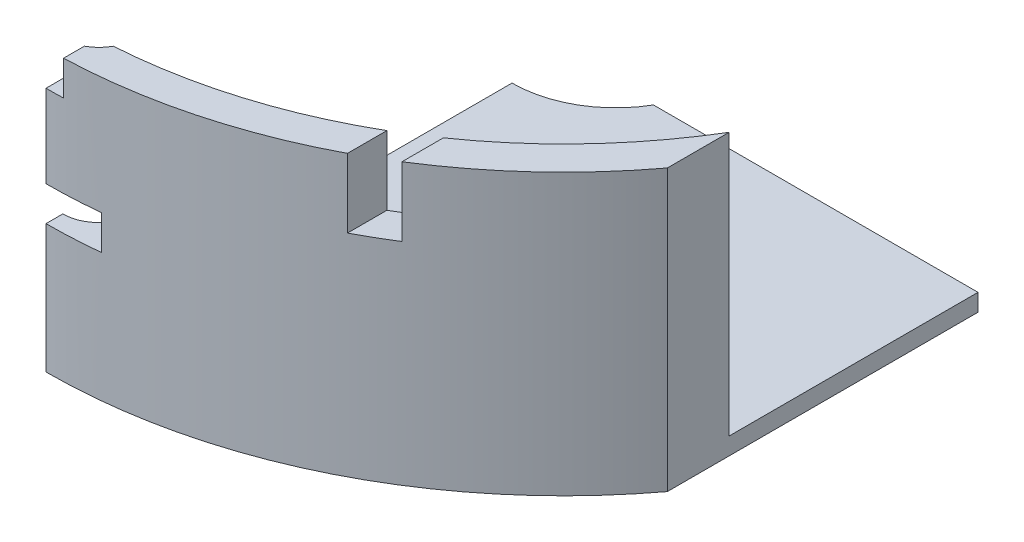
SolidWorks part; units mm, degrees
ref_plane "Front Plane" through (0, 0, 0) normal (0, 0, 1) x (1, 0, 0)
ref_plane "Top Plane" through (0, 0, 0) normal (0, 1, 0) x (1, 0, 0)
ref_plane "Right Plane" through (0, 0, 0) normal (1, 0, 0) x (0, 0, -1)
sketch "Sketch1" plane through (0, 0, 0) normal (0, 1, 0) x (1, 0, 0)
  line L0 (0, 0) -> (150, 0)
  line L1 (150, 0) -> (-150, 0)
  circle A0 centre (0, 0) radius 150
  circle A1 centre (0, 0) radius 145
  dimension "D1" = 300
  dimension "D2" = 290
extrude "Boss-Extrude1" add sketch "Sketch1" along normal blind 5
sketch "Sketch3" plane through (0, 5, 0) normal (0, 1, 0) x (1, 0, 0)
  line L0 (0, 0) -> (0, -150)
  arc A0 (-150, 0) -> (150, 0) centre (0, 0) ccw construction
  circle A1 centre (0, -134.6406) radius 10.5
  dimension "D1" = 21
  dimension "D2" = 15.3594
extrude "Cut-Extrude2" cut sketch "Sketch3" against normal blind 10 contours L0 A1 | L0 A1
sketch "Sketch4" plane through (0, 5, 0) normal (0, 1, 0) x (1, 0, 0)
  line L0 (0, -150) -> (120, -150)
  line L1 (0, -150) -> (-120, -150)
  line L2 (-120, -150) -> (-120, 0)
  line L3 (-120, 0) -> (120, 0)
  line L4 (120, 0) -> (120, -150)
  line L5 (-120, 0) -> (-150, 0)
  line L6 (120, 0) -> (150, 0)
  arc A0 (-150, 0) -> (150, 0) centre (0, 0) ccw construction
  circle A1 centre (0, 0) radius 150
  dimension "D1" = 120
  dimension "D2" = 120
  dimension "D3" = 150
extrude "Cut-Extrude3" cut sketch "Sketch4" against normal blind 10 contours L2 M7 M6 | L4 M8 M7
sketch "Sketch5" plane through (0, 5, 0) normal (0, 1, 0) x (1, 0, 0)
  line L0 (0, -150) -> (0, -15)
  line L1 (0, -15) -> (0, 15)
  line L2 (0, 15) -> (-30, 15)
  line L3 (-30, 15) -> (-90, 15)
  arc A0 (-120, -90) -> (120, -90) centre (0, 0) ccw construction
  circle A1 centre (0, 15) radius 30
  circle A2 centre (-90, 15) radius 7.5
  dimension "D4" = 15
  dimension "D1" = 135
  dimension "D2" = 30
  dimension "D3" = 60
extrude "Cut-Extrude4" cut sketch "Sketch5" against normal blind 10 contours A1 L1 M4 | L1 A1 M4
sketch "Sketch6" plane through (0, 5, 0) normal (0, 1, 0) x (1, 0, 0)
  line L0 (0, -87.1406) -> (0, -124.1406)
  circle A1 centre (0, -73.1406) radius 14
  circle A2 centre (0, -134.6406) radius 10.5 construction
  dimension "D1" = 28
  dimension "D2" = 37
extrude "Cut-Extrude5" cut sketch "Sketch6" against normal blind 10 contours A1
sketch "Sketch7" plane through (0, 5, 0) normal (0, 1, 0) x (1, 0, 0)
  line L0 (-120, -90) -> (-120, 0)
  line L1 (-120, 0) -> (120, 0)
  line L2 (120, 0) -> (120, -90)
  circle A0 centre (0, 0) radius 150
  circle A1 centre (0, 0) radius 140
  dimension "D1" = 300
  dimension "D2" = 280
extrude "Boss-Extrude2" add sketch "Sketch7" along normal blind 76.2 contours A1 L0 M5 M6
sketch "Sketch9" plane through (0, 0, 0) normal (0, 0, 1) x (1, 0, 0)
  line L0 (120, 81.2) -> (-120, 81.2)
  line L1 (-120, 81.2) -> (-120, 5)
  line L2 (-120, 5) -> (120, 5)
  line L3 (120, 5) -> (120, 81.2)
  line L4 (0, 81.2) -> (0, 5)
  line L5 (0, 5) -> (0, 37.2405)
  line L6 (0, 37.2405) -> (15.24, 37.2405)
  line L7 (15.24, 37.2405) -> (15.24, 47.2405)
  line L8 (15.24, 47.2405) -> (0, 47.2405)
  line L9 (0, 47.2405) -> (-15.24, 47.2405)
  line L10 (-15.24, 47.2405) -> (-15.24, 37.2405)
  line L11 (-15.24, 37.2405) -> (0, 37.2405)
  line L12 (0, 81.2) -> (70, 81.2)
  line L13 (70, 81.2) -> (70, 61.2)
  line L14 (70, 61.2) -> (80, 61.2)
  line L15 (80, 61.2) -> (80, 81.2)
  line L16 (80, 81.2) -> (70, 81.2)
  line L17 (-1.8852, 81.2) -> (-70, 81.2)
  line L18 (-70, 81.2) -> (-70, 71.2)
  line L19 (-70, 71.2) -> (-80, 71.2)
  line L20 (-80, 71.2) -> (-80, 81.2)
  line L21 (-80, 81.2) -> (-70, 81.2)
  line L22 (80, 81.2) -> (-80, 81.2)
  line L23 (0, 81.2) -> (-5, 81.2)
  line L24 (-5, 81.2) -> (-5, 71.2)
  line L25 (-5, 71.2) -> (5, 71.2)
  line L26 (5, 71.2) -> (5, 81.2)
  line L27 (5, 81.2) -> (0, 81.2)
  dimension "D1" = 10
  dimension "D2" = 15.24
  dimension "D3" = 15.24
  dimension "D4" = 10
  dimension "D5" = 10
  dimension "D6" = 70
  dimension "D7" = 70
  dimension "D8" = 20
  dimension "D9" = 10
  dimension "D10" = 5
  dimension "D11" = 5
  dimension "D12" = 10
extrude "Cut-Extrude6" cut sketch "Sketch9" along normal blind 210.2 contours L7 L8 L4 L6 | L10 L11 L4 L9 | L24 L25 L4 L0 | L25 L26 L22 L4 | L14 L15 L0 L13 | L20 L19 L18 L0
sketch "Sketch11" plane through (0, 0, 0) normal (0, 1, 0) x (1, 0, 0)
  line L1 (-130.1103, 5.0367) -> (0, 5.0367)
  line L2 (-130.1103, 5.0367) -> (-130.1103, -167.4539)
  line L3 (-130.1103, -167.4539) -> (0, -167.4539)
  line L4 (0, 5.0367) -> (0, -167.4539)
extrude "Cut-Extrude7" cut sketch "Sketch11" along normal blind 114
ref_plane "Plane1" through (25.9808, 5, 0) normal (0.5, 0, -0.866) x (-0.866, 0, -0.5)
sketch "Sketch13" plane through (0, 5, 0) normal (0, 1, 0) x (1, 0, 0)
  line L1 (0, -15) -> (0, -59.1406) construction
  circle A0 centre (0, 15) radius 30
  dimension "D1" = 60
